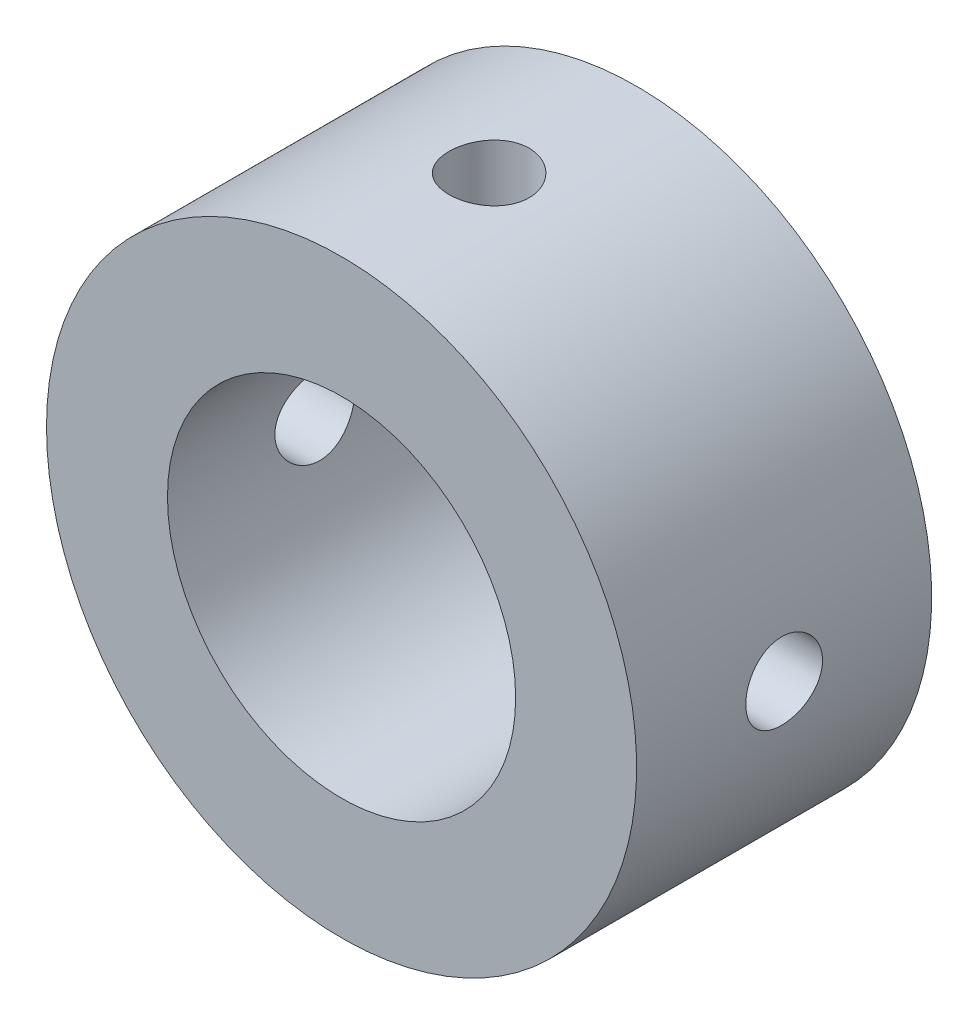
SolidWorks part; units mm, degrees
ref_plane "Front Plane" through (0, 0, 0) normal (0, 0, 1) x (1, 0, 0)
ref_plane "Top Plane" through (0, 0, 0) normal (0, 1, 0) x (1, 0, 0)
ref_plane "Right Plane" through (0, 0, 0) normal (1, 0, 0) x (0, 0, -1)
sketch "Sketch1" plane through (0, 0, 0) normal (0, 0, 1) x (1, 0, 0)
  line L1 (-12.7, -12.7) -> (12.7, -12.7)
  line L2 (-12.7, -12.7) -> (-12.7, 12.7)
  line L3 (-12.7, 12.7) -> (12.7, 12.7)
  line L4 (12.7, -12.7) -> (12.7, 12.7)
  line L5 (-12.7, -12.7) -> (12.7, 12.7) construction
  line L6 (-12.7, 12.7) -> (12.7, -12.7) construction
  point P0 (0, 0)
extrude "Boss-Extrude1" add sketch "Sketch1" along normal blind 12.7
hole_wizard "#8-32 Tapped Hole1" positions "Sketch2" profile "Sketch3" tap size "#8-32" standard "ANSI Inch"
sketch "Sketch2" plane through (0, 12.7, 0) normal (0, 1, 0) x (1, 0, 0)
  point P0 (0, -6.35)
  dimension "D1" = 6.35
sketch "Sketch3" plane through (0, 12.7, 6.35) normal (1, 0, 0) x (0, 0, 1)
  line L0 (0, 0) -> (0, 13.7378)
  line L1 (0, 13.7378) -> (1.7272, 12.7)
  line L2 (1.7272, 12.7) -> (1.7272, 0)
  line L5 (1.7272, 0) -> (0, 0)
  line L10 (0, 13.7378) -> (-1.7272, 12.7) construction
  line L11 (0, -6.35) -> (0, 107.95) construction
  dimension "Tap Drill Dia." = 3.4544
  dimension "Tap Drill Depth" = 12.7
  dimension "Drill Angle" = 118
hole_wizard "#8-32 Tapped Hole2" positions "Sketch4" profile "Sketch5" tap size "#8-32" standard "ANSI Inch"
sketch "Sketch4" plane through (-12.7, 0, 0) normal (-1, 0, 0) x (0, 0, 1)
  line L0 (12.7, 12.7) -> (0, 12.7) construction
  point P0 (6.35, 0)
  dimension "D1" = 6.35
  dimension "D2" = 12.7
sketch "Sketch5" plane through (-12.7, 0, 6.35) normal (0, 1, 0) x (0, 0, 1)
  line L0 (0, 0) -> (0, 13.7378)
  line L1 (0, 13.7378) -> (1.7272, 12.7)
  line L2 (1.7272, 12.7) -> (1.7272, 0)
  line L5 (1.7272, 0) -> (0, 0)
  line L10 (0, 13.7378) -> (-1.7272, 12.7) construction
  line L11 (0, -6.35) -> (0, 107.95) construction
  dimension "Tap Drill Dia." = 3.4544
  dimension "Tap Drill Depth" = 12.7
  dimension "Drill Angle" = 118
hole_wizard "M4x0.7 Tapped Hole1" positions "Sketch6" profile "Sketch7" tap size "M4x0.7" standard "ANSI Metric"
sketch "Sketch6" plane through (12.7, 0, 0) normal (1, 0, 0) x (0, 0, -1)
  line L0 (-12.7, -12.7) -> (-12.7, 12.7) construction
  point P0 (-6.35, 0)
  dimension "D1" = 6.35
sketch "Sketch7" plane through (12.7, 0, 6.35) normal (0, 1, 0) x (0, 0, -1)
  line L0 (0, 0) -> (0, 11.0914)
  line L1 (0, 11.0914) -> (1.65, 10.1)
  line L2 (1.65, 10.1) -> (1.65, 0)
  line L5 (1.65, 0) -> (0, 0)
  line L10 (0, 11.0914) -> (-1.65, 10.1) construction
  line L11 (0, -6.35) -> (0, 107.95) construction
  dimension "Tap Drill Dia." = 3.3
  dimension "Tap Drill Depth" = 10.1
  dimension "Drill Angle" = 118
sketch "Sketch8" plane through (0, 0, 0) normal (0, 0, -1) x (-1, 0, 0)
  line L1 (-12.7, -12.7) -> (12.7, -12.7)
  line L2 (-12.7, -12.7) -> (-12.7, 12.7)
  line L3 (-12.7, 12.7) -> (12.7, 12.7)
  line L4 (12.7, -12.7) -> (12.7, 12.7)
  line L5 (-12.7, -12.7) -> (12.7, 12.7) construction
  line L6 (-12.7, 12.7) -> (12.7, -12.7) construction
  circle A0 centre (0, 0) radius 12.7
  circle A1 centre (0, 0) radius 7.493
extrude "Cut-Extrude1" cut sketch "Sketch8" against normal through all contours A1 | A0 L3 M3 | A0 L4 M6 | A0 L1 M5 | A0 L2 M4
